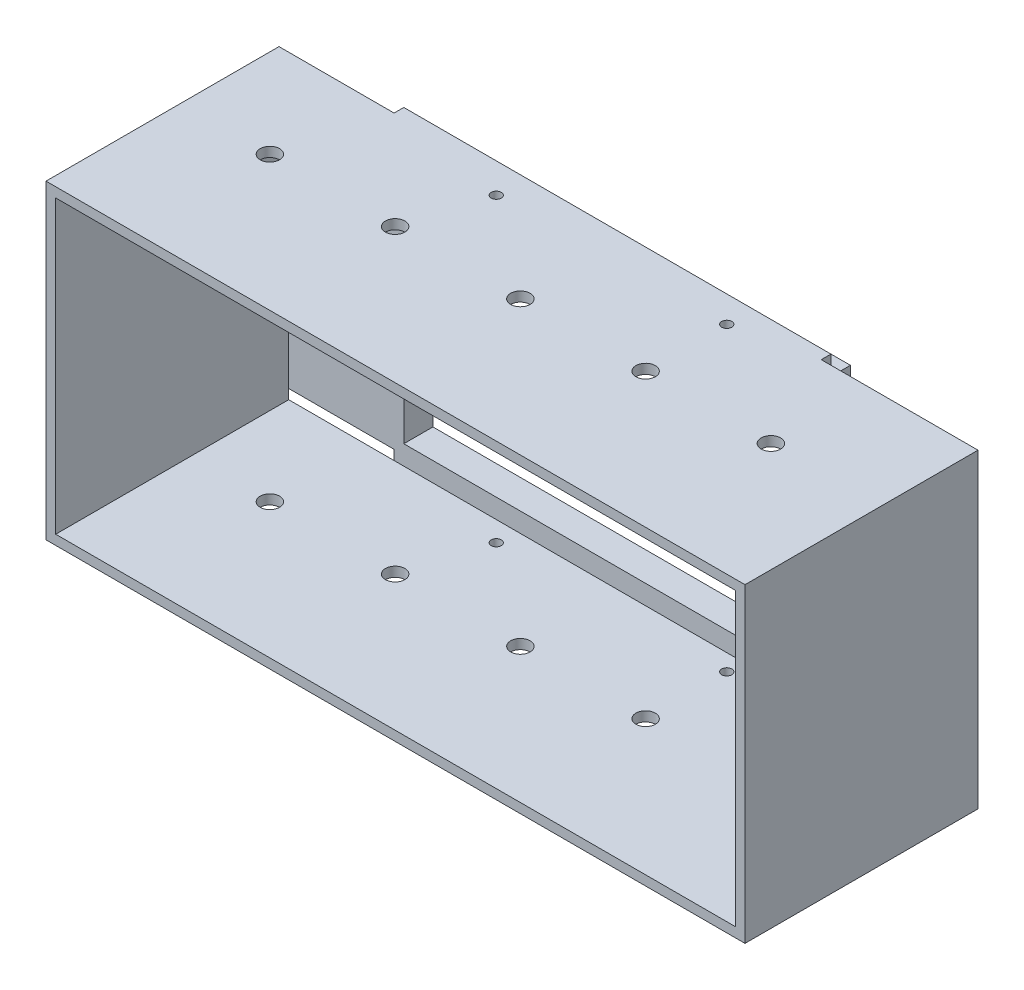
SolidWorks part; units mm, degrees
ref_plane "Front Plane" through (0, 0, 0) normal (0, 0, 1) x (1, 0, 0)
ref_plane "Top Plane" through (0, 0, 0) normal (0, 1, 0) x (1, 0, 0)
ref_plane "Right Plane" through (0, 0, 0) normal (1, 0, 0) x (0, 0, -1)
sketch "Sketch1" plane through (0, 0, 0) normal (0, 0, 1) x (1, 0, 0)
  line L0 (-66.4958, 26.3606) -> (66.8542, 26.3606)
  line L1 (-69.6708, 29.5356) -> (70.0292, 29.5356) construction
  line L2 (-69.6708, 29.5356) -> (-69.6708, -59.3644) construction
  line L3 (-69.6708, -59.3644) -> (70.0292, -59.3644) construction
  line L4 (70.0292, 29.5356) -> (70.0292, -59.3644) construction
  line L5 (-69.6708, 35.8856) -> (70.0292, 35.8856)
  line L6 (-107.315, 29.5356) -> (-107.315, -59.3644)
  line L7 (-69.6708, -65.7144) -> (70.0292, -65.7144)
  line L8 (76.3792, 29.5356) -> (76.3792, -59.3644)
  line L9 (66.8542, 26.3606) -> (66.8542, -56.1894)
  line L10 (-66.4958, -56.1894) -> (66.8542, -56.1894)
  line L11 (-66.4958, 26.3606) -> (-66.4958, -56.1894)
  line L12 (-69.6708, 35.8856) -> (-69.6708, 29.5356)
  line L13 (-69.6708, 29.5356) -> (-107.315, 29.5356)
  line L14 (-107.315, -59.3644) -> (-69.6708, -59.3644)
  line L15 (-69.6708, -59.3644) -> (-69.6708, -65.7144)
  line L16 (70.0292, -65.7144) -> (70.0292, -59.3644)
  line L17 (70.0292, -59.3644) -> (76.3792, -59.3644)
  line L18 (70.0292, 35.8856) -> (70.0292, 29.5356)
  line L19 (70.0292, 29.5356) -> (76.3792, 29.5356)
  line L20 (0, 0) -> (-107.315, 0) construction
  dimension "D2" = 107.315
  dimension "D1" = 3.175
extrude "Boss-Extrude1" add sketch "Sketch1" along normal blind 3.175
sketch "Sketch3" plane through (0, 0, 0) normal (0, 0, -1) x (-1, 0, 0)
  line L0 (69.6708, 29.5356) -> (-70.0292, 29.5356)
  line L1 (66.4958, 26.3606) -> (-66.8542, 26.3606)
  line L2 (66.4958, 26.3606) -> (66.4958, -56.1894)
  line L3 (66.4958, -56.1894) -> (-66.8542, -56.1894)
  line L4 (-66.8542, 26.3606) -> (-66.8542, -56.1894)
  line L5 (-70.0292, 29.5356) -> (-70.0292, -59.3644)
  line L6 (69.6708, -59.3644) -> (-70.0292, -59.3644)
  line L7 (69.6708, 29.5356) -> (69.6708, -59.3644)
  dimension "D1" = 3.175
extrude "Boss-Extrude2" add sketch "Sketch3" along normal blind 6.35
sketch "Sketch5" plane through (0, 0, 0) normal (0, 1, 0) x (1, 0, 0)
  line L0 (109.2351, -34.0218) -> (-133.2148, -34.0218) construction
  line L1 (-29.7031, -9.7506) -> (-29.7031, -35.1506) construction
  line L4 (78.4352, 57.15) -> (78.4352, 0) construction
  line L5 (44.5643, 57.15) -> (78.4352, 57.15) construction
  line L6 (44.5643, 17.907) -> (44.5643, 57.15) construction
  circle A0 centre (44.5643, -35.1506) radius 20.4809 construction
  circle A1 centre (44.5643, 17.907) radius 20.4809 construction
  circle A2 centre (3.6025, -35.1506) radius 20.4809 construction
  circle A3 centre (-37.3592, -35.1506) radius 20.4809 construction
  circle A4 centre (-78.3209, -35.1506) radius 20.4809 construction
  circle A5 centre (85.526, -35.1506) radius 20.4809 construction
  circle A6 centre (-29.7031, -9.7506) radius 6.0479 construction
  circle A7 centre (44.5643, -8.6218) radius 6.0479 construction
  dimension "D1" = 25.4
  dimension "D2" = 40.9617
  dimension "D3" = 40.9617
  dimension "D4" = 40.9617
  dimension "D5" = 40.9617
  dimension "D6" = 40.9617
sketch "Sketch4" plane through (0, 0, 3.175) normal (0, 0, 1) x (1, 0, 0)
  line L0 (-104.14, 32.7106) -> (118.11, 32.7106)
  line L1 (-107.315, 35.8856) -> (121.285, 35.8856)
  line L2 (-107.315, 35.8856) -> (-107.315, -65.7144)
  line L3 (-107.315, -65.7144) -> (121.285, -65.7144)
  line L4 (121.285, 35.8856) -> (121.285, -65.7144)
  line L5 (118.11, 32.7106) -> (118.11, -62.5394)
  line L6 (-104.14, -62.5394) -> (118.11, -62.5394)
  line L7 (-104.14, 32.7106) -> (-104.14, -62.5394)
  line L8 (0, 0) -> (-104.14, 0) construction
  line L9 (-69.6708, -65.7144) -> (70.0292, -65.7144) construction
  line L12 (70.0292, 35.8856) -> (-69.6708, 35.8856) construction
  dimension "D2" = 228.6
  dimension "D3" = 104.14
  dimension "D1" = 3.175
extrude "Boss-Extrude3" add sketch "Sketch4" along normal blind 76.2
sketch "Sketch6" plane through (0, 0, 0) normal (0, 0, 1) x (1, 0, 0)
  line L0 (-107.315, 35.8856) -> (-107.315, -65.7144)
  line L1 (121.285, 35.8856) -> (-107.315, 35.8856) construction
  line L2 (121.285, 35.8856) -> (121.285, -65.7144)
  line L3 (0, 0) -> (-107.315, 0)
  line L4 (109.2351, 0) -> (-133.2148, 0) construction
sketch "Sketch8" plane through (0, -65.7144, 0) normal (0, -1, 0) x (1, 0, 0)
  circle A0 centre (-78.3209, 35.1506) radius 3.175
  circle A1 centre (-37.3592, 35.1506) radius 3.175
  circle A2 centre (3.6025, 35.1506) radius 3.175
  circle A3 centre (44.5643, 35.1506) radius 3.175
  circle A4 centre (85.526, 35.1506) radius 3.175
  circle A5 centre (-29.7031, 9.7506) radius 1.651
  circle A6 centre (44.5643, 8.6218) radius 1.651
extrude "Cut-Extrude1" cut sketch "Sketch8" against normal blind 138.938
